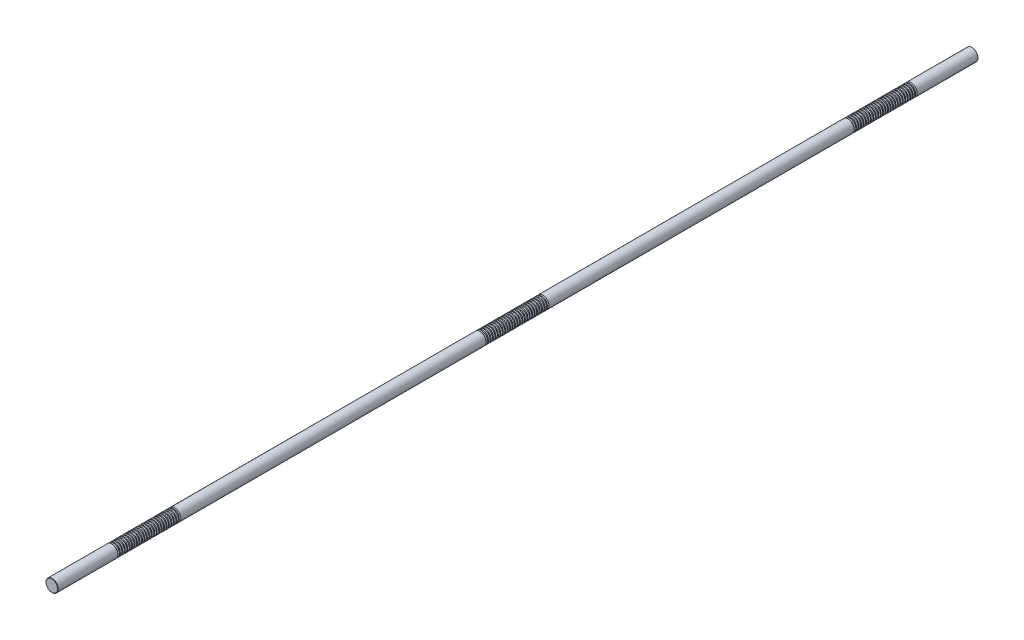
SolidWorks part; units mm, degrees
ref_plane "Front Plane" through (0, 0, 0) normal (0, 0, 1) x (1, 0, 0)
ref_plane "Top Plane" through (0, 0, 0) normal (0, 1, 0) x (1, 0, 0)
ref_plane "Right Plane" through (0, 0, 0) normal (1, 0, 0) x (0, 0, -1)
sketch "Sketch1" plane through (0, 0, 0) normal (0, 0, 1) x (1, 0, 0)
  circle A0 centre (0, 0) radius 10
  dimension "D1" = 20
extrude "Boss-Extrude1" add sketch "Sketch1" along normal mid plane 1500
chamfer "Chamfer1" distance 0.5 angle 45 2 edges at (10, 0, -750) (10, 0, 750)
sketch "Sketch2" plane through (0, 0, 0) normal (1, 0, 0) x (0, 0, -1)
  line L0 (650.3014, 10) -> (647.6986, 10)
  line L1 (749.5, 10) -> (-749.5, 10) construction
  line L2 (647.6986, 10) -> (648.3014, 7.75)
  line L3 (648.3014, 7.75) -> (649.6986, 7.75)
  line L4 (649.6986, 7.75) -> (650.3014, 10)
  line L5 (750, -9.5) -> (750, 9.5) construction
  point P4 (649, 10)
  point P7 (649, 7.75)
  point P8 (650, 8.875)
  point P9 (648, 8.875)
  dimension "D1" = 2
  dimension "D2" = 100
  dimension "D3" = 2.25
  dimension "D4" = 30
revolve "Cut-Revolve1" cut sketch "Sketch2" angle 360 about axis through (0, 0, 750) along (0, 0, -1)
pattern_linear "LPattern1" count 26 spacing 4 along (0, 0, 1) of "Cut-Revolve1"
pattern_linear "LPattern2" count 3 spacing 600 along (0, 0, 1) of "Cut-Revolve1", "LPattern1"
